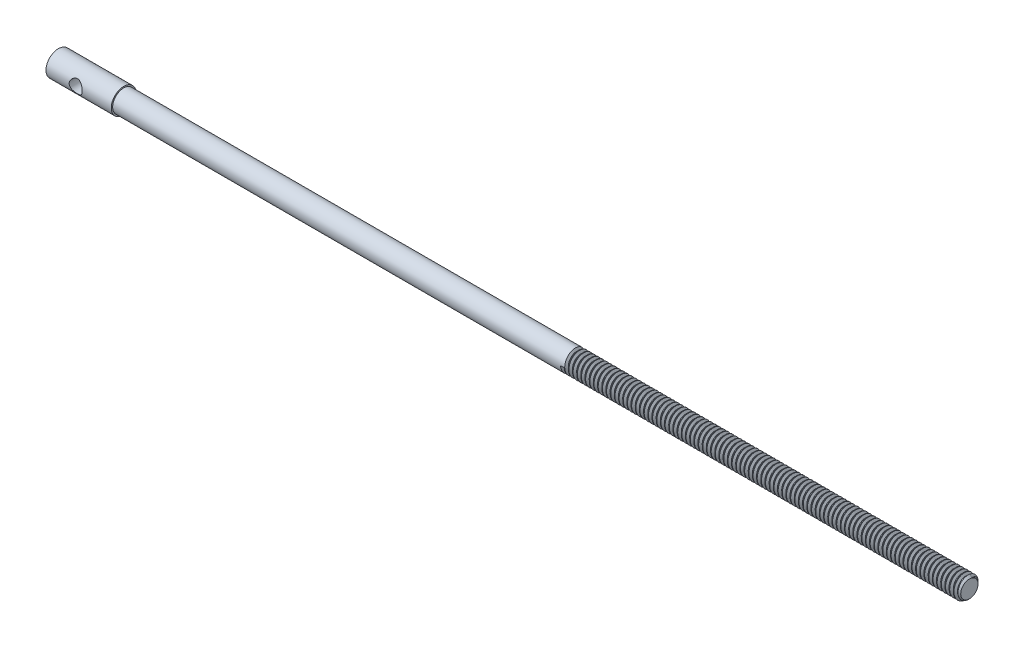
SolidWorks part; units mm, degrees
ref_plane "Front Plane" through (0, 0, 0) normal (0, 0, 1) x (1, 0, 0)
ref_plane "Top Plane" through (0, 0, 0) normal (0, 1, 0) x (1, 0, 0)
ref_plane "Right Plane" through (0, 0, 0) normal (1, 0, 0) x (0, 0, -1)
sketch "Sketch1" plane through (0, 0, 0) normal (1, 0, 0) x (0, 0, -1)
  circle A0 centre (0, 0) radius 1.5748
  dimension "D1" = 3.1496
extrude "Boss-Extrude1" add sketch "Sketch1" along normal blind 8.255
sketch "Sketch2" plane through (8.255, 0, 0) normal (1, 0, 0) x (0, 0, -1)
  circle A0 centre (0, 0) radius 1.397
  dimension "D1" = 2.794
extrude "Boss-Extrude2" add sketch "Sketch2" along normal blind 106.934
chamfer "Chamfer1" distance 0.3048 angle 45 1 edges at (115.189, 0, -1.397)
sketch "Sketch11" plane through (0, 0, 0) normal (0, 0, 1) x (1, 0, 0)
  line L0 (114.8842, 0) -> (3.7592, 0) construction
  line L1 (114.8842, -1.397) -> (114.8842, 1.397) construction
  circle A0 centre (3.7592, 0) radius 0.8255
  dimension "D1" = 1.651
  dimension "D2" = 111.125
extrude "Cut-Extrude1" cut sketch "Sketch11" against normal through all both and the other way through all
sketch "Sketch12" plane through (115.189, 0, 0) normal (1, 0, 0) x (0, 0, -1)
  circle A0 centre (0, 0) radius 1.397 construction
  circle A1 centre (0, 0) radius 1.397
thread "Thread3" pitch 0.5292 start angle 0, offset 1.27, length 50.8, pitch 0.5292, diameter 2.794
ref_plane "Plane2" through (116.1542, 0, 1.397) normal (0, -1, 0) x (0, 0, 1)
sketch "Thread Profile1" plane through (116.1542, 0, 1.397) normal (0, -1, 0) x (0, 0, 1)
  line L0 (0, 0) -> (0, 0.5292) construction
  line L11 (0, 0) -> (0, 0.463)
  line L12 (0, 0.463) -> (-0.2864, 0.2977)
  line L13 (-0.2864, 0.2977) -> (-0.2864, 0.1654)
  line L15 (-0.2864, 0.1654) -> (0, 0)
  line L17 (-0.2864, 0.2315) -> (0, 0.2315) construction
  point P2 (0, 0)
  dimension "Pitch" = 0.5292
  dimension "Profile_Angle" = 60
  dimension "Profile_Land" = 0.1323
  dimension "Profile_Height" = 0.2864
